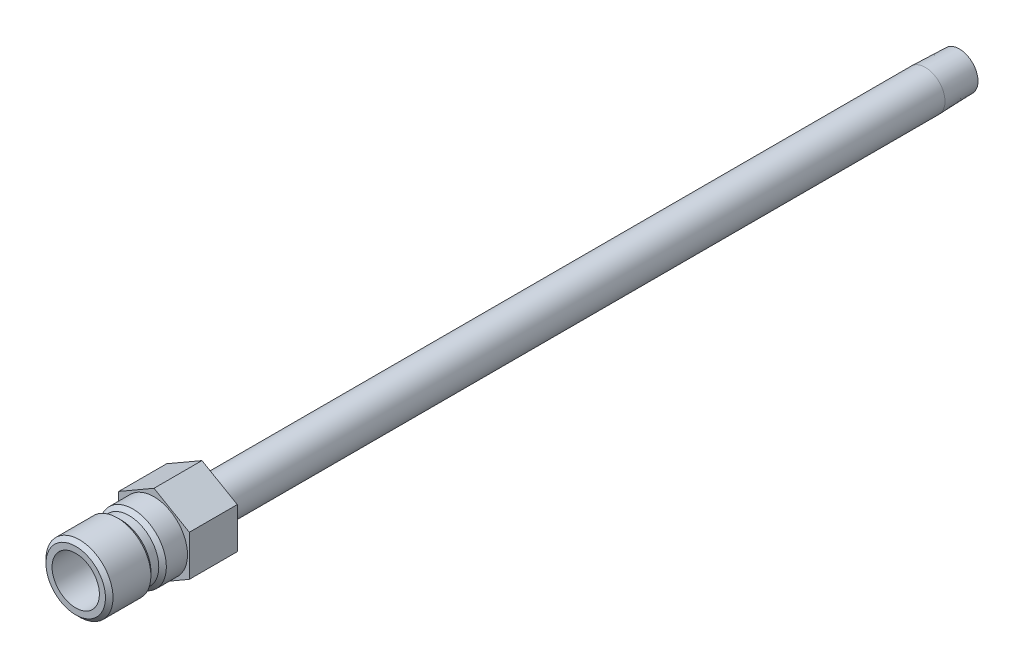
SolidWorks part; units mm, degrees
ref_plane "Front Plane" through (0, 0, 0) normal (0, 0, 1) x (1, 0, 0)
ref_plane "Top Plane" through (0, 0, 0) normal (0, 1, 0) x (1, 0, 0)
ref_plane "Right Plane" through (0, 0, 0) normal (1, 0, 0) x (0, 0, -1)
sketch "Sketch1" plane through (0, 0, 0) normal (1, 0, 0) x (0, 0, -1)
  line L0 (9.652, 0) -> (-18.923, 0) construction
  line L1 (-15.748, 4.7625) -> (-15.748, 5.9817)
  line L2 (-6.604, 5.9817) -> (-6.604, 0) construction
  line L3 (-14.986, 6.7437) -> (-7.366, 6.7437)
  line L4 (0, 6.7437) -> (0, 0) construction
  line L5 (-6.604, 5.9817) -> (-5.0165, 5.9817)
  line L6 (-4.2545, 6.7437) -> (9.652, 6.7437)
  line L7 (9.652, 6.7437) -> (9.652, 3.9688)
  line L8 (-6.604, 5.9817) -> (-7.366, 6.7437)
  line L9 (-5.0165, 5.9817) -> (-4.2545, 6.7437)
  line L10 (-15.748, 5.9817) -> (-14.986, 6.7437)
  line L11 (-3.556, 4.7625) -> (-2.4351, 2.6543)
  line L12 (9.652, 3.9688) -> (155.194, 3.9688)
  line L13 (155.194, 3.9688) -> (162.052, 3.7544)
  line L14 (162.052, 3.7544) -> (162.052, 2.6543)
  line L16 (9.652, 6.731) -> (9.652, 0) construction
  line L19 (-3.556, 4.7625) -> (-15.748, 4.7625)
  line L20 (-2.4351, 2.6543) -> (162.052, 2.6543)
  dimension "D2" = 1.5875
  dimension "D3" = 0.762
  dimension "D4" = 45
  dimension "D5" = 9.144
  dimension "D6" = 45
  dimension "D7" = 1.79
  dimension "D8" = 6.858
  dimension "D9" = 177.8
  dimension "D10" = 3.175
  dimension "D11" = 9.525
  dimension "D12" = 7.9375
  dimension "D13" = 25.4
  dimension "D14" = 13.4874
  dimension "D15" = 5.3086
  dimension "D16" = 9.652
  dimension "D17" = 118
  dimension "D18" = 12.192
revolve "Revolve1" add sketch "Sketch1" angle 360 about L0
sketch "Sketch2" plane through (0, 0, 0) normal (0, 0, 1) x (1, 0, 0)
  line L1 (-7.112, 4.1061) -> (-7.112, -4.1061)
  line L2 (-7.112, -4.1061) -> (0, -8.2122)
  line L3 (0, -8.2122) -> (7.112, -4.1061)
  line L4 (7.112, -4.1061) -> (7.112, 4.1061)
  line L5 (7.112, 4.1061) -> (0, 8.2122)
  line L6 (0, 8.2122) -> (-7.112, 4.1061)
  circle A0 centre (0, 0) radius 7.112 construction
  circle A2 centre (0, 0) radius 2.6543
  circle A3 centre (0, 0) radius 2.6543 construction
  dimension "D1" = 14.224
extrude "Boss-Extrude1" add sketch "Sketch2" against normal up to vertex (9.652 mm away)
